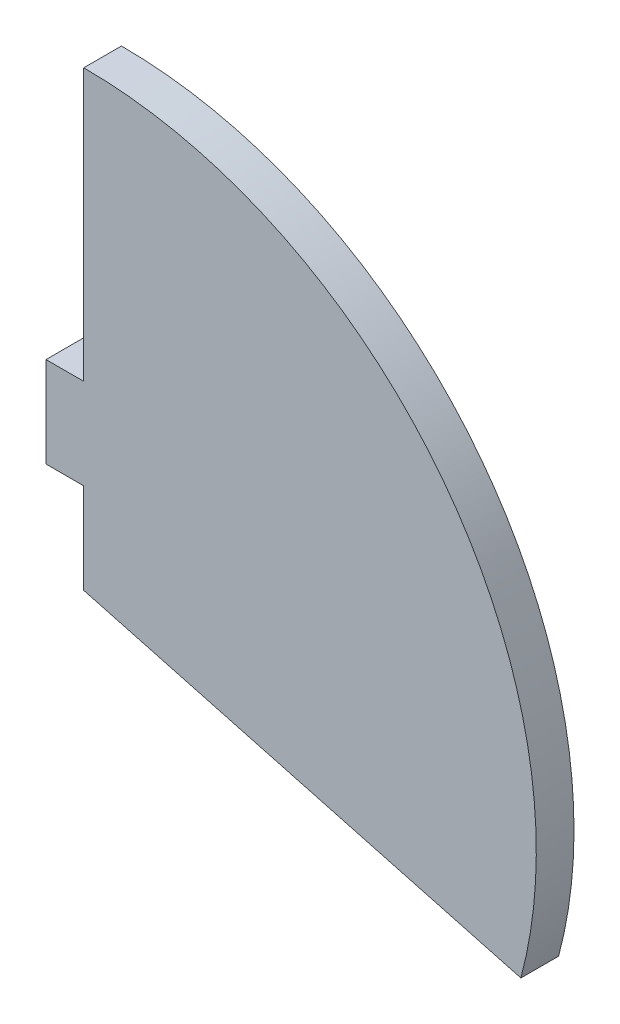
SolidWorks part; units mm, degrees
ref_plane "Front" through (0, 0, 0) normal (0, 0, 1) x (1, 0, 0)
ref_plane "Top" through (0, 0, 0) normal (0, 1, 0) x (1, 0, 0)
ref_plane "Right" through (0, 0, 0) normal (1, 0, 0) x (0, 0, -1)
sketch "草图1" plane through (0, 0, 0) normal (0, 0, 1) x (1, 0, 0)
  line L0 (0, 0) -> (0, 6)
  line L1 (0, 0) -> (28.9778, -7.7646)
  line L2 (0, 6) -> (-2.5, 6)
  line L3 (-2.5, 6) -> (-2.5, 12)
  line L4 (-2.5, 12) -> (0, 12)
  line L5 (0, 12) -> (0, 30)
  arc A0 (28.9778, -7.7646) -> (0, 30) centre (0, 0) ccw
  dimension "D1" = 105
  dimension "D2" = 2.5
  dimension "D3" = 6
  dimension "D4" = 6
  dimension "D5" = 18
extrude "凸台-拉伸1" add sketch "草图1" along normal blind 2.5 contours L5 A0 L1 L0 L2 L3 L4
